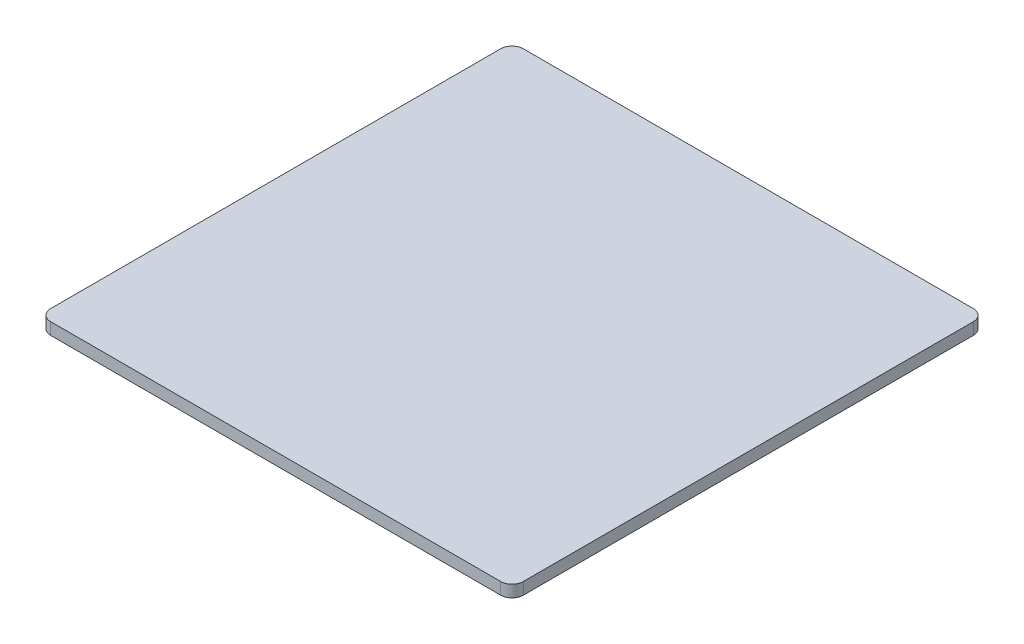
SolidWorks part; units mm, degrees
ref_plane "Front Plane" through (0, 0, 0) normal (0, 0, 1) x (1, 0, 0)
ref_plane "Top Plane" through (0, 0, 0) normal (0, 1, 0) x (1, 0, 0)
ref_plane "Right Plane" through (0, 0, 0) normal (1, 0, 0) x (0, 0, -1)
sketch "Sketch1" plane through (0, 0, 0) normal (0, 1, 0) x (1, 0, 0)
  line L1 (-15.875, -15.875) -> (15.875, -15.875)
  line L2 (-15.875, -15.875) -> (-15.875, 15.875)
  line L3 (-15.875, 15.875) -> (15.875, 15.875)
  line L4 (15.875, -15.875) -> (15.875, 15.875)
  line L5 (-15.875, -15.875) -> (15.875, 15.875) construction
  line L6 (-15.875, 15.875) -> (15.875, -15.875) construction
  point P0 (0, 0)
  dimension "D1" = 31.75
  dimension "D2" = 31.75
extrude "Boss-Extrude1" add sketch "Sketch1" along normal mid plane 0.8
fillet "Fillet1" radius 0.762 4 edges at (-15.875, 0, -15.875) (15.875, 0, -15.875) (15.875, 0, 15.875) (-15.875, 0, 15.875)
